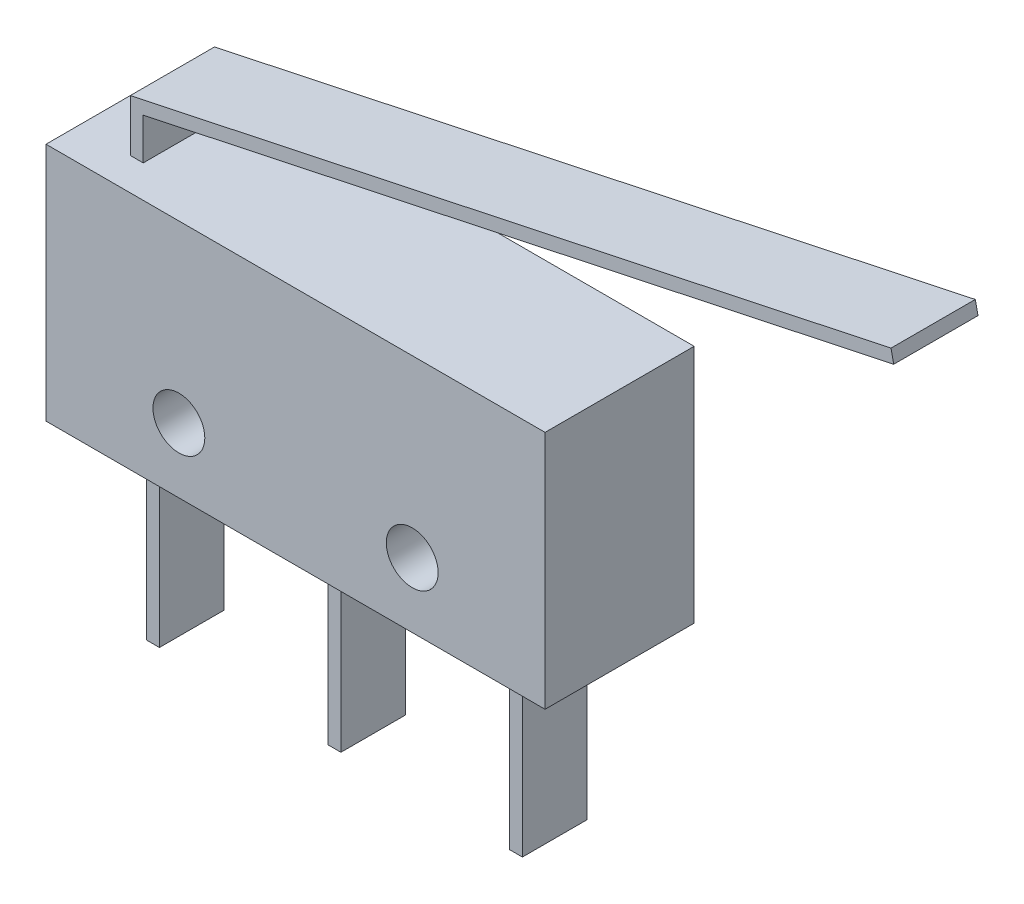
SolidWorks part; units mm, degrees
ref_plane "Front Plane" through (0, 0, 0) normal (0, 0, 1) x (1, 0, 0)
ref_plane "Top Plane" through (0, 0, 0) normal (0, 1, 0) x (1, 0, 0)
ref_plane "Right Plane" through (0, 0, 0) normal (1, 0, 0) x (0, 0, -1)
sketch "Sketch1" plane through (0, 0, 0) normal (0, 0, 1) x (1, 0, 0)
  line L1 (9.779, -4.699) -> (-9.779, -4.699)
  line L2 (9.779, -4.699) -> (9.779, 4.699)
  line L3 (9.779, 4.699) -> (-9.779, 4.699)
  line L4 (-9.779, -4.699) -> (-9.779, 4.699)
  line L5 (9.779, -4.699) -> (-9.779, 4.699) construction
  line L6 (9.779, 4.699) -> (-9.779, -4.699) construction
  point P0 (0, 0)
  dimension "D1" = 19.558
  dimension "D2" = 9.398
extrude "Boss-Extrude1" add sketch "Sketch1" along normal mid plane 5.842
sketch "Sketch2" plane through (0, 0, 2.921) normal (0, 0, 1) x (1, 0, 0)
  line L0 (0, -2.159) -> (-4.572, -2.159) construction
  line L1 (0, -3.2131) -> (0, 3.2131) construction
  line L2 (0, -2.159) -> (4.572, -2.159) construction
  line L3 (9.779, 4.699) -> (-9.779, 4.699) construction
  circle A0 centre (-4.572, -2.159) radius 1.016
  circle A1 centre (4.572, -2.159) radius 1.016
  dimension "D3" = 2.032
  dimension "D1" = 9.144
  dimension "D2" = 6.858
extrude "Cut-Extrude1" cut sketch "Sketch2" against normal through all
sketch "Sketch3" plane through (0, 0, 0) normal (0, 0, 1) x (1, 0, 0)
  line L0 (-7.747, 4.699) -> (-7.747, 6.731)
  line L2 (9.779, 4.699) -> (-9.779, 4.699) construction
  line L3 (-7.747, 6.731) -> (22.0669, 13.0681)
  line L4 (-9.779, 4.699) -> (-9.779, -4.699) construction
  dimension "D1" = 2.032
  dimension "D2" = 2.032
  dimension "D3" = 30.48
  dimension "D4" = 12
extrude "Extrude-Thin1" add sketch "Sketch3" along normal mid plane 3.302 separate body thin
sketch "Sketch4" plane through (0, 0, 0) normal (0, 0, 1) x (1, 0, 0)
  line L0 (-9.779, -4.699) -> (9.779, -4.699) construction
  line L1 (-7.493, -4.699) -> (-6.985, -4.699)
  line L2 (-7.493, -4.699) -> (-7.493, -11.811)
  line L3 (-7.493, -11.811) -> (-6.985, -11.811)
  line L4 (-6.985, -4.699) -> (-6.985, -11.811)
  line L5 (-9.779, 4.699) -> (-9.779, -4.699) construction
  line L6 (-0.381, -4.699) -> (0.127, -4.699)
  line L7 (-0.381, -4.699) -> (-0.381, -11.811)
  line L8 (-0.381, -11.811) -> (0.127, -11.811)
  line L9 (0.127, -4.699) -> (0.127, -11.811)
  line L10 (6.731, -4.699) -> (7.239, -4.699)
  line L11 (6.731, -4.699) -> (6.731, -11.811)
  line L12 (6.731, -11.811) -> (7.239, -11.811)
  line L13 (7.239, -4.699) -> (7.239, -11.811)
  dimension "D1" = 7.112
  dimension "D2" = 0.508
  dimension "D3" = 6.604
  dimension "D4" = 6.604
  dimension "D5" = 2.286
extrude "Boss-Extrude2" add sketch "Sketch4" along normal mid plane 2.54
